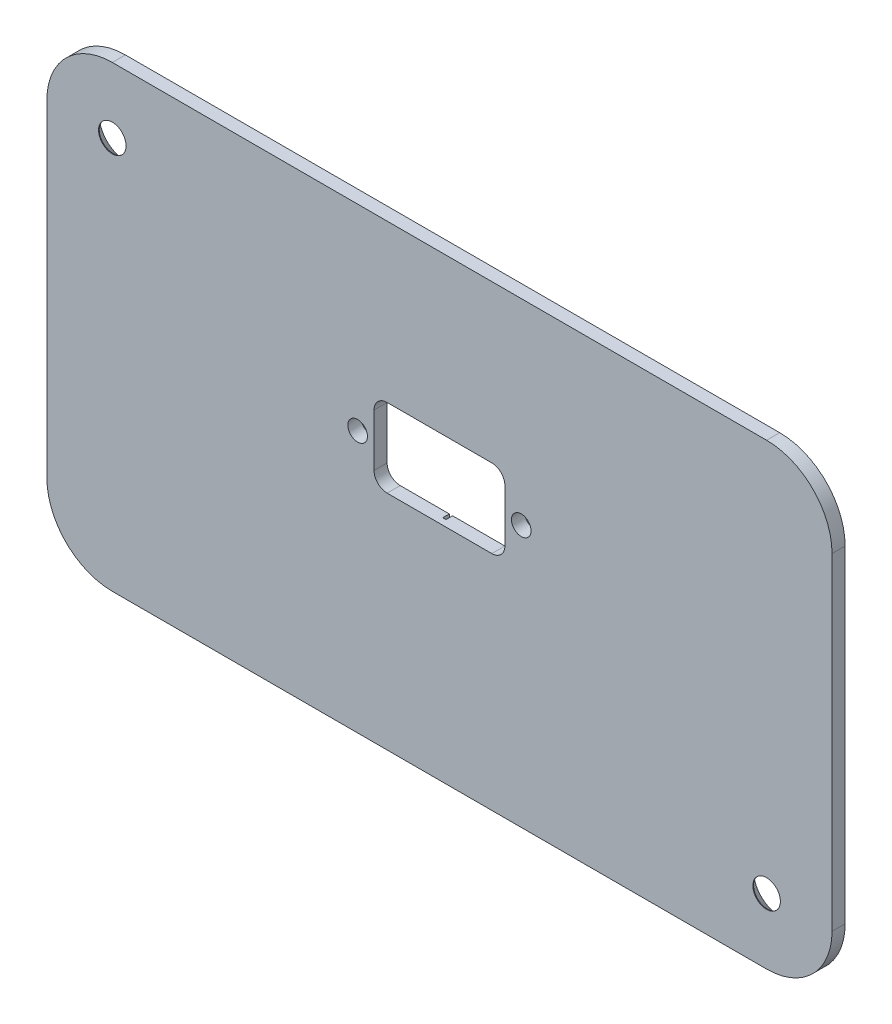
SolidWorks part; units mm, degrees
ref_plane "Plan de face" through (0, 0, 0) normal (0, 0, 1) x (1, 0, 0)
ref_plane "Plan de dessus" through (0, 0, 0) normal (0, 1, 0) x (1, 0, 0)
ref_plane "Plan de droite" through (0, 0, 0) normal (1, 0, 0) x (0, 0, -1)
sketch "Esquisse1" plane through (0, 0, 0) normal (0, 0, 1) x (1, 0, 0)
  line L1 (0, 0) -> (120, 0)
  line L2 (0, 0) -> (0, 70)
  line L3 (0, 70) -> (120, 70)
  line L4 (120, 0) -> (120, 70)
  dimension "D1" = 120
  dimension "D2" = 70
extrude "Boss.-Extru.1" add sketch "Esquisse1" along normal blind 2
fillet "Congé1" radius 10 4 edges at (120, 0, 1) (0, 0, 1) (0, 70, 1) (120, 70, 1)
sketch "Esquisse2" plane through (0, 0, 2) normal (0, 0, 1) x (1, 0, 0)
  line L0 (0, 60) -> (0, 10) construction
  line L1 (110, 70) -> (10, 70) construction
  line L2 (120, 10) -> (120, 60) construction
  line L3 (10, 0) -> (110, 0) construction
  circle A0 centre (10, 60) radius 2.1
  circle A1 centre (110, 10) radius 2.1
  dimension "D1" = 10
  dimension "D5" = 4.2
  dimension "D6" = 4.2
  dimension "D2" = 10
  dimension "D3" = 10
  dimension "D4" = 10
extrude "Enlèv. mat.-Extru.1" cut sketch "Esquisse2" against normal through all
chamfer "Chanfrein2" distance 1.9 angle 45 2 edges at (12.1, 60, 0) (112.1, 10, 0)
sketch "Esquisse3" plane through (0, 0, 0) normal (0, 0, -1) x (-1, 0, 0)
  line L0 (-120, 10) -> (-120, 60) construction
  line L1 (-70, 46) -> (-50, 46)
  line L2 (-70, 46) -> (-70, 34)
  line L3 (-70, 34) -> (-50, 34)
  line L4 (-50, 46) -> (-50, 34)
  line L6 (-110, 70) -> (-10, 70) construction
  circle A0 centre (-72.5, 40) radius 1.5
  circle A1 centre (-47.5, 40) radius 1.5
  dimension "D3" = 25
  dimension "D5" = 3
  dimension "D6" = 3
  dimension "D1" = 20
  dimension "D2" = 12
  dimension "D4" = 2.5
  dimension "D7" = 6
  dimension "D8" = 50
  dimension "D9" = 24
  dimension "D10" = 2.5
extrude "Enlèv. mat.-Extru.2" cut sketch "Esquisse3" against normal through all
fillet "Congé2" radius 2 4 edges at (70, 34, 1) (50, 34, 1) (50, 46, 1) (70, 46, 1)
sketch "Esquisse4" plane through (0, 0, 0) normal (0, 0, -1) x (-1, 0, 0)
  line L0 (-68, 34) -> (-52, 34) construction
  line L1 (-60, 34) -> (-59.5, 34)
  line L2 (-60, 34) -> (-60, 25.5724)
  line L3 (-60, 25.5724) -> (-59.5, 25.5724)
  line L4 (-59.5, 34) -> (-59.5, 25.5724)
  line L5 (-70, 44) -> (-70, 36) construction
  text T0 "12 CFA"
  text T1 "1 WWA"
  dimension "D1" = 0.5
  dimension "D2" = 10
extrude "Enlèv. mat.-Extru.5" cut sketch "Esquisse4" against normal blind 1
